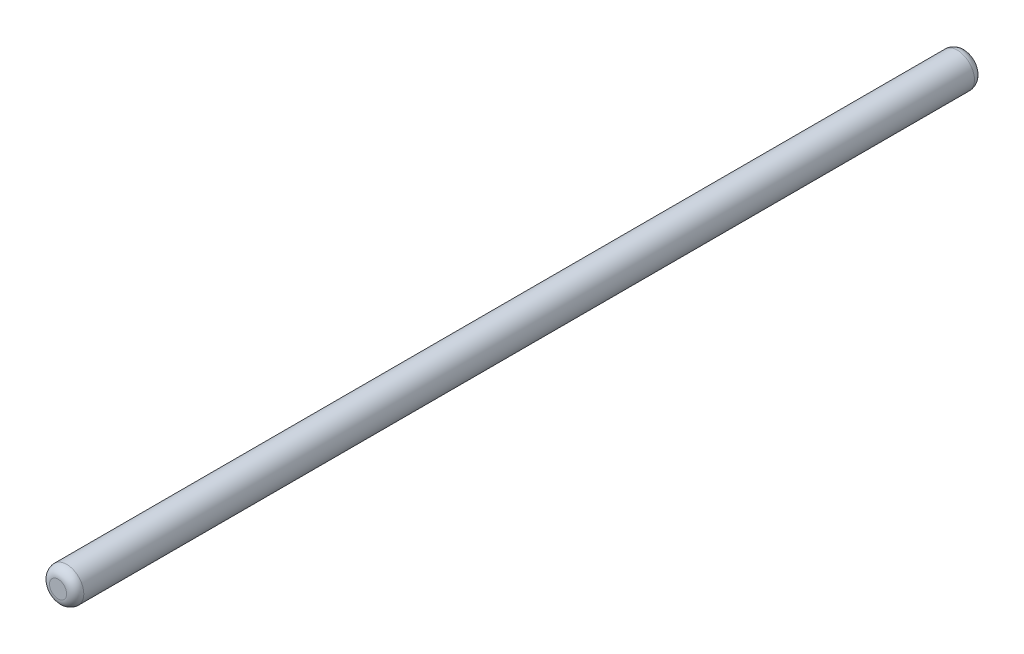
SolidWorks part; units mm, degrees
ref_plane "Plan1" through (0, 0, 0) normal (0, 0, 1) x (1, 0, 0)
ref_plane "Plan2" through (0, 0, 0) normal (0, 1, 0) x (1, 0, 0)
ref_plane "Plan3" through (0, 0, 0) normal (1, 0, 0) x (0, 0, -1)
sketch "Esquisse1" plane through (0, 0, 0) normal (0, 0, 1) x (1, 0, 0)
  circle A0 centre (0, 0) radius 2
  dimension "D1" = 4
extrude "Base-Extrusion" add sketch "Esquisse1" along normal blind 106
fillet "Congé2" radius 1
